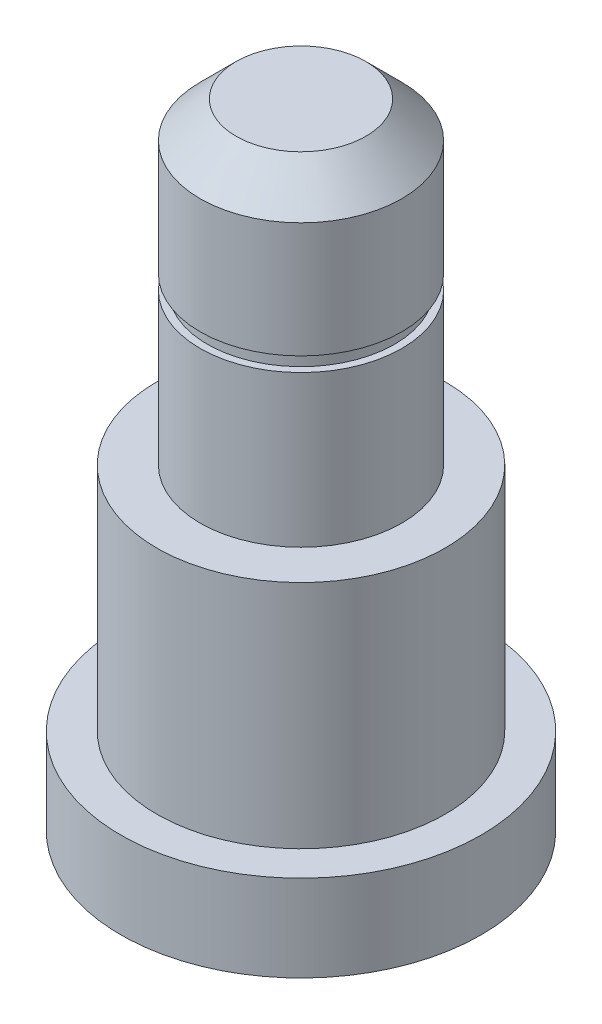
SolidWorks part; units mm, degrees
ref_plane "Plano frontal" through (0, 0, 0) normal (0, 0, 1) x (1, 0, 0)
ref_plane "Plano superior" through (0, 0, 0) normal (0, 1, 0) x (1, 0, 0)
ref_plane "Plano direito" through (0, 0, 0) normal (1, 0, 0) x (0, 0, -1)
sketch "Esboço1" plane through (0, 0, 0) normal (0, 0, 1) x (1, 0, 0)
  line L0 (0, 0) -> (12.5, 0)
  line L1 (12.5, 0) -> (12.5, 6)
  line L2 (12.5, 6) -> (10, 6)
  line L3 (10, 6) -> (10, 22)
  line L4 (10, 22) -> (7, 22)
  line L5 (7, 22) -> (7, 32.5)
  line L6 (7, 32.5) -> (6.5, 32.5)
  line L7 (6.5, 32.5) -> (6.5, 33.5)
  line L8 (6.5, 33.5) -> (7, 33.5)
  line L9 (7, 33.5) -> (7, 41.5)
  line L10 (7, 41.5) -> (4.5, 44)
  line L11 (4.5, 44) -> (0, 44)
  line L12 (0, 44) -> (0, 0)
  dimension "D1" = 6
  dimension "D2" = 16
  dimension "D3" = 22
  dimension "D4" = 10.5
  dimension "D5" = 10.5
  dimension "D6" = 0.5
  dimension "D7" = 7
  dimension "D8" = 10
  dimension "D9" = 45
  dimension "D10" = 2.5
  dimension "D11" = 12.5
revolve "Revolução1" add sketch "Esboço1" angle 360 about L12
